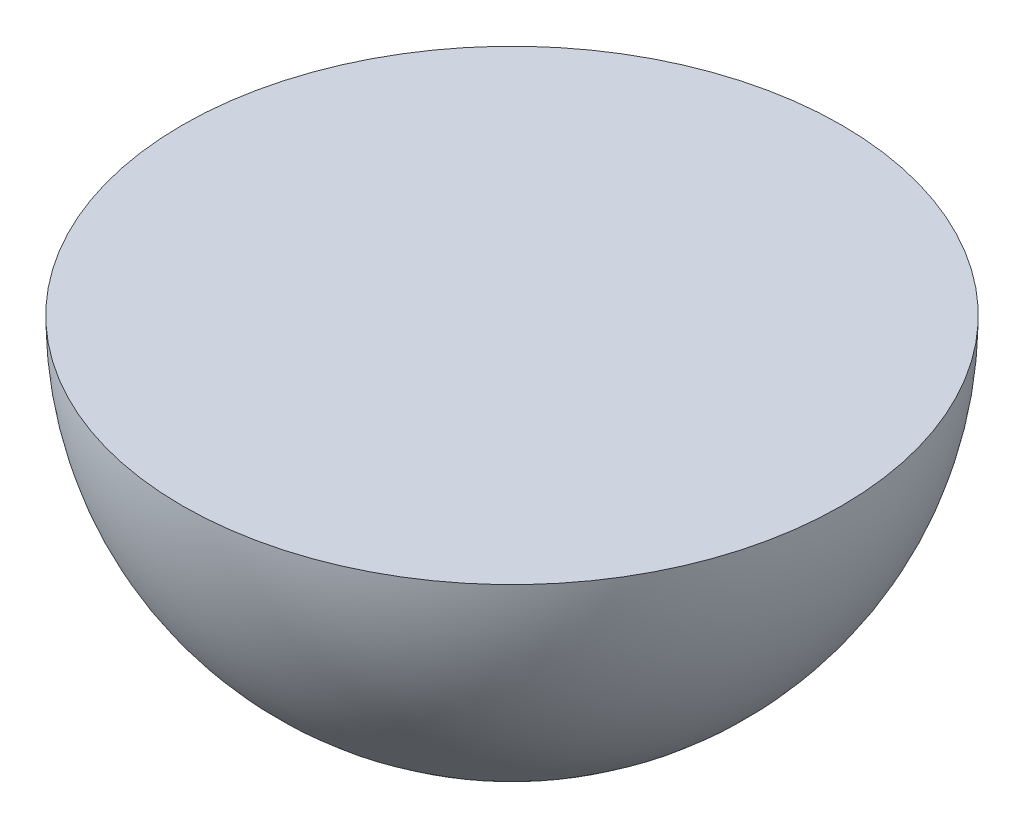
SolidWorks part; units mm, degrees
ref_plane "Ebene vorne" through (0, 0, 0) normal (0, 0, 1) x (1, 0, 0)
ref_plane "Ebene oben" through (0, 0, 0) normal (0, 1, 0) x (1, 0, 0)
ref_plane "Ebene rechts" through (0, 0, 0) normal (1, 0, 0) x (0, 0, -1)
sketch "Skizze2" plane through (0, 0, 0) normal (0, 0, 1) x (1, 0, 0)
  line L1 (0, -190) -> (0, 0) construction
  line L2 (0, -190.7) -> (0, -189.3)
  line L3 (-190.7, 0) -> (0, 0)
  line L4 (0, 0) -> (0, -189.3)
  arc A0 (-190, 0) -> (0, -190) centre (0, 0) ccw construction
  arc A1 (-190.7, 0) -> (0, -190.7) centre (0, 0) ccw
  arc A2 (-105.3868, 158.9343) -> (0, -190.7) centre (0, 0) ccw construction
  arc A4 (-105, 158.3509) -> (0, -190) centre (0, 0) ccw construction
  dimension "D1" = 0.7
revolve "Rotation2" add sketch "Skizze2" angle 360 about L1
ref_plane "Ebene1" through (0, 10, 0) normal (0, 1, 0) x (1, 0, 0)
